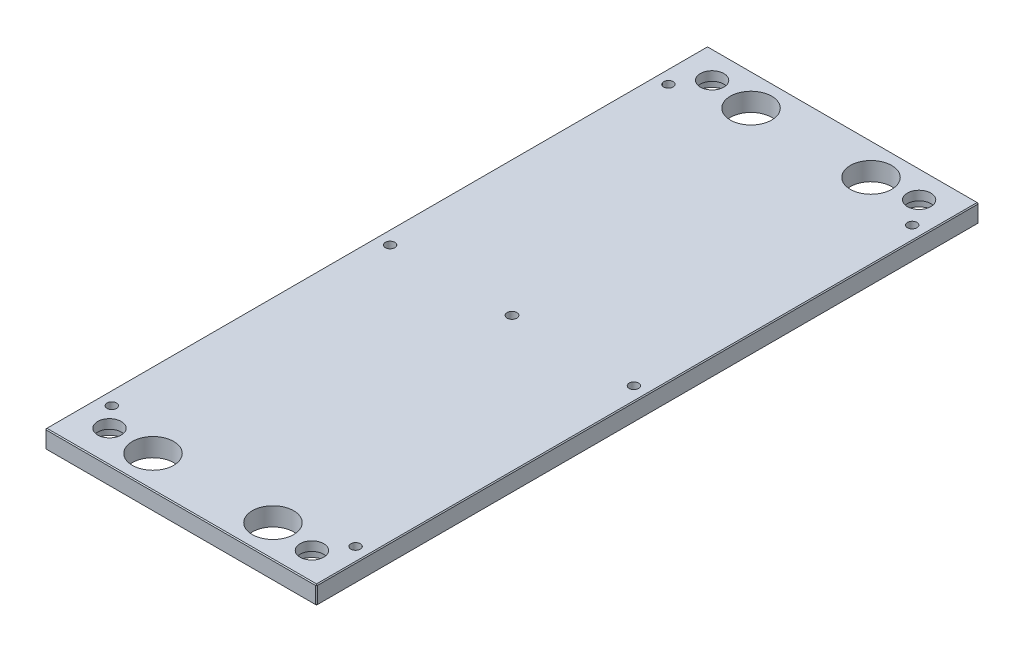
SolidWorks part; units mm, degrees
ref_plane "Plane1" through (0, 0, 0) normal (0, 0, 1) x (1, 0, 0)
ref_plane "Plane2" through (0, 0, 0) normal (0, 1, 0) x (1, 0, 0)
ref_plane "Plane3" through (0, 0, 0) normal (1, 0, 0) x (0, 0, -1)
sketch "Sketch1" plane through (0, 0, 0) normal (0, 0, 1) x (1, 0, 0)
  line L0 (-93.6625, -12.7) -> (93.6625, -12.7)
  line L1 (-93.6625, -12.7) -> (-93.6625, -25.4)
  line L2 (93.6625, -25.4) -> (-93.6625, -25.4)
  line L3 (93.6625, -25.4) -> (93.6625, -12.7)
  dimension "HT" = 12.7
  dimension "W" = 187.325
  dimension "halfW" = 93.6625
extrude "Base-Extrude" add sketch "Sketch1" along normal mid plane 457.2
hole_wizard "RP1" positions "RP1ctrl" profile "RP1rev" legacy
sketch "RP1ctrl" plane through (0, -25.4, 0) normal (0, -1, 0) x (1, 0, 0)
  point P0 (71.4375, -209.55)
sketch "RP1rev" plane through (71.4375, -25.4, -209.55) normal (1, 0, 0) x (0, 0, -1)
  line L0 (0, 0) -> (0, 12.7)
  line L1 (0, 12.7) -> (8.1359, 12.7)
  line L2 (8.1359, 12.7) -> (8.1359, 6.35)
  line L3 (8.1359, 6.35) -> (11.9062, 6.35)
  line L4 (11.9062, 6.35) -> (11.9062, 0)
  line L5 (11.9062, 0) -> (0, 0)
  line L6 (0, 110) -> (0, -10) construction
  dimension "Depth" = 12.7
hole_wizard "RP2" positions "RP2ctrl" profile "RP2rev" legacy
sketch "RP2ctrl" plane through (0, -25.4, 0) normal (0, -1, 0) x (1, 0, 0)
  point P0 (71.4375, 209.55)
sketch "RP2rev" plane through (71.4375, -25.4, 209.55) normal (1, 0, 0) x (0, 0, -1)
  line L0 (0, 0) -> (0, 12.7)
  line L1 (0, 12.7) -> (8.1359, 12.7)
  line L2 (8.1359, 12.7) -> (8.1359, 6.35)
  line L3 (8.1359, 6.35) -> (11.9062, 6.35)
  line L4 (11.9062, 6.35) -> (11.9062, 0)
  line L5 (11.9062, 0) -> (0, 0)
  line L6 (0, 110) -> (0, -10) construction
  dimension "Depth" = 12.7
hole_wizard "RP3" positions "RP3ctrl" profile "RP3rev" legacy
sketch "RP3ctrl" plane through (0, -25.4, 0) normal (0, -1, 0) x (1, 0, 0)
  point P0 (-71.4375, 206.375)
sketch "RP3rev" plane through (-71.4375, -25.4, 206.375) normal (1, 0, 0) x (0, 0, -1)
  line L0 (0, 0) -> (0, 12.7)
  line L1 (0, 12.7) -> (8.1359, 12.7)
  line L2 (8.1359, 12.7) -> (8.1359, 6.35)
  line L3 (8.1359, 6.35) -> (11.9062, 6.35)
  line L4 (11.9062, 6.35) -> (11.9062, 0)
  line L5 (11.9062, 0) -> (0, 0)
  line L6 (0, 110) -> (0, -10) construction
  dimension "Depth" = 12.7
hole_wizard "RP4" positions "RP4ctrl" profile "RP4rev" legacy
sketch "RP4ctrl" plane through (0, -25.4, 0) normal (0, -1, 0) x (1, 0, 0)
  point P0 (-71.4375, -209.55)
sketch "RP4rev" plane through (-71.4375, -25.4, -209.55) normal (1, 0, 0) x (0, 0, -1)
  line L0 (0, 0) -> (0, 12.7)
  line L1 (0, 12.7) -> (8.1359, 12.7)
  line L2 (8.1359, 12.7) -> (8.1359, 6.35)
  line L3 (8.1359, 6.35) -> (11.9062, 6.35)
  line L4 (11.9062, 6.35) -> (11.9062, 0)
  line L5 (11.9062, 0) -> (0, 0)
  line L6 (0, 110) -> (0, -10) construction
  dimension "Depth" = 12.7
hole_wizard "SP" positions "SPctrl" profile "SPrev" legacy
sketch "SPctrl" plane through (0, -25.4, 0) normal (0, -1, 0) x (1, 0, 0)
  point P0 (0, 0)
sketch "SPrev" plane through (0, -25.4, 0) normal (1, 0, 0) x (0, 0, -1)
  line L0 (0, 0) -> (0, 12.7)
  line L1 (0, 12.7) -> (3.3734, 12.7)
  line L2 (3.3734, 12.7) -> (3.3734, 6.35)
  line L3 (3.3734, 6.35) -> (6.35, 6.35)
  line L4 (6.35, 6.35) -> (6.35, 0)
  line L5 (6.35, 0) -> (0, 0)
  line L6 (0, 110) -> (0, -10) construction
  dimension "Diameter" = 6.7469
  dimension "Depth" = 12.7
  dimension "C-Bore Diameter" = 12.7
  dimension "C-Bore Depth" = 6.35
other "Tap1"
sketch "Tap1ctrl" plane through (0, -12.7, 0) normal (0, 1, 0) x (-1, 0, 0)
  circle A0 centre (-84.1375, -192.0875) radius 3.2639
sketch "Tap2ctrl" plane through (-4.6859, -12.7, 559.3634) normal (0, 1, 0) x (-1, 0, 0)
  circle A0 centre (-88.8234, -367.2759) radius 3.2639
other "Tap2"
sketch "Tap3ctrl" plane through (-246.9305, -12.7, 555.6004) normal (0, 1, 0) x (-1, 0, 0)
  circle A0 centre (-162.793, -363.5129) radius 3.2639
other "Tap3"
sketch "Tap4ctrl" plane through (-242.1128, -12.7, 3.0677) normal (0, 1, 0) x (-1, 0, 0)
  circle A0 centre (-157.9753, -195.1552) radius 3.2639
other "Tap4"
chamfer "EdgeBreak" distance 0.635 angle 45 12 edges at (93.6625, -19.05, 228.6) (0, -12.7, 228.6) (-93.6625, -19.05, 228.6) (0, -12.7, -228.6) (93.6625, -19.05, -228.6) (0, -25.4, -228.6) (-93.6625, -19.05, -228.6) (0, -25.4, 228.6) (-93.6625, -12.7, 0) (93.6625, -12.7, 0) (93.6625, -25.4, 0) (-93.6625, -25.4, 0)
other "Guide1"
sketch "Eject1" plane through (0, -12.7, 0) normal (0, 1, 0) x (-1, 0, 0)
  circle A0 centre (-41.402, -206.375) radius 14.2875
sketch "Eject2" plane through (-6.583, -12.7, 141.4013) normal (0, 1, 0) x (-1, 0, 0)
  circle A0 centre (-47.985, 64.9737) radius 14.2875
other "Guide2"
sketch "Eject3" plane through (-89.1847, -12.7, 141.2568) normal (0, 1, 0) x (-1, 0, 0)
  circle A0 centre (-47.7827, 65.1182) radius 14.2875
other "Guide3"
sketch "Eject4" plane through (-87.4522, -12.7, -4.2965) normal (0, 1, 0) x (-1, 0, 0)
  circle A0 centre (-46.0502, -202.0785) radius 14.2875
other "Guide4"
sketch "Eject5" plane through (-44.7398, -12.7, -3.6657) normal (0, 1, 0) x (-1, 0, 0)
  line L0 (-44.7398, 53.6657) -> (-44.7398, -46.3343) construction
  circle A0 centre (-44.7398, -202.7093) radius 14.2875
other "Guide5" [suppressed]
sketch "Eject6" plane through (-49.7118, -12.7, 139.2167) normal (0, 1, 0) x (-1, 0, 0)
  line L0 (-49.7118, -89.2167) -> (-49.7118, -189.2167) construction
  circle A0 centre (-49.7118, 67.1583) radius 14.2875
other "Guide6" [suppressed]
sketch "Sketch2" plane through (-12.7244, -12.7, 75.2256) normal (0, 1, 0) x (-1, 0, 0)
  line L0 (37.2756, -75.2256) -> (-62.7244, -75.2256) construction
  circle A0 centre (-96.8619, -75.2256) radius 3.2639
  dimension "MinDia" = 6.5278
other "Tap5"
sketch "Sketch3" plane through (-178.3085, -12.7, 80.2428) normal (0, 1, 0) x (-1, 0, 0)
  line L0 (-128.3085, -80.2428) -> (-228.3085, -80.2428) construction
  circle A0 centre (-94.171, -80.2428) radius 3.2639
  dimension "MinDia" = 6.5278
other "Tap6"
